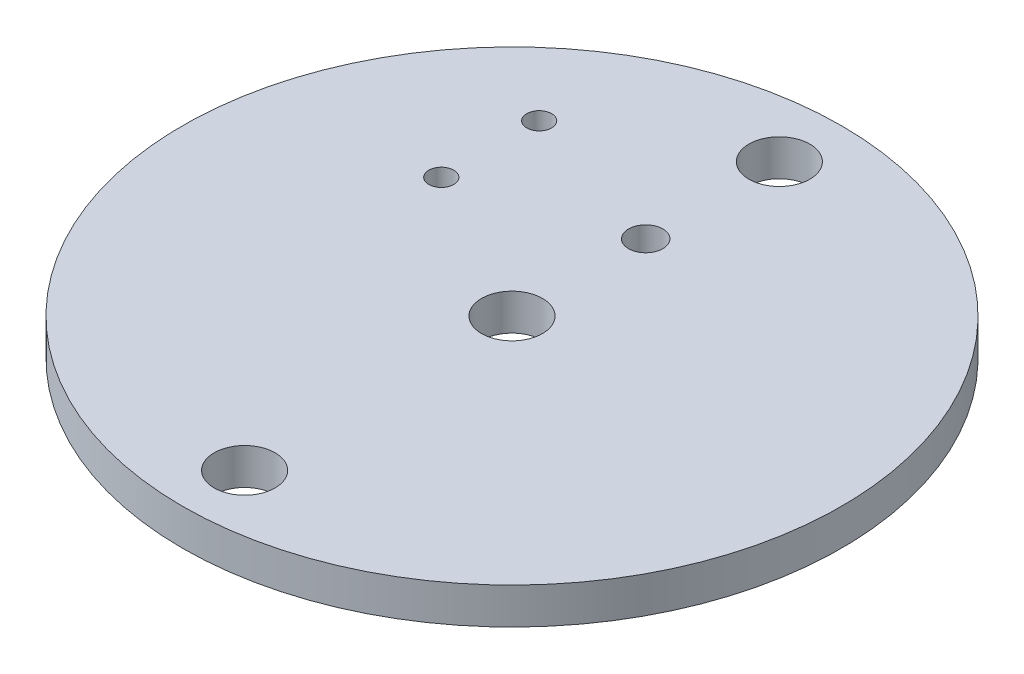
SolidWorks part; units mm, degrees
ref_plane "Front Plane" through (0, 0, 0) normal (0, 0, 1) x (1, 0, 0)
ref_plane "Top Plane" through (0, 0, 0) normal (0, 1, 0) x (1, 0, 0)
ref_plane "Right Plane" through (0, 0, 0) normal (1, 0, 0) x (0, 0, -1)
sketch "Sketch1" plane through (0, 0, 0) normal (0, 1, 0) x (1, 0, 0)
  circle A0 centre (0, 0) radius 26.924
  dimension "D1" = 53.848
extrude "Boss-Extrude1" add sketch "Sketch1" along normal blind 2.9718
hole_wizard "#10 Clearance Hole1" positions "Sketch3" profile "Sketch4" hole size "#10" standard "ANSI Inch"
sketch "Sketch3" plane through (0, 2.9718, 0) normal (0, 1, 0) x (1, 0, 0)
  line L0 (-26.924, 0) -> (26.924, 0) construction
  line L2 (0, 26.924) -> (0, -26.924) construction
  circle A0 centre (0, 0) radius 26.924 construction
  point P0 (0, 0)
  point P21 (0, -21.844)
  point P23 (0, 21.844)
  dimension "D1" = 21.844
  dimension "D2" = 21.844
sketch "Sketch4" plane through (0, 2.9718, 0) normal (1, 0, 0) x (0, 0, 1)
  line L0 (0, 0) -> (0, 2.9718)
  line L1 (0, 2.9718) -> (2.4892, 2.9718)
  line L2 (2.4892, 2.9718) -> (2.4892, 0)
  line L5 (2.4892, 0) -> (0, 0)
  line L11 (0, -6.35) -> (0, 107.95) construction
  dimension "Thru Hole Dia." = 4.9784
  dimension "Thru Hole Depth" = 2.9718
sketch "Sketch5" plane through (0, 2.9718, 0) normal (0, 1, 0) x (1, 0, 0)
  line L0 (0, 21.844) -> (0, 0) construction
  line L1 (0, 10.922) -> (-19.0071, 10.922) construction
  line L2 (-7.747, 17.7165) -> (7.747, 17.7165) construction
  line L3 (-7.747, 17.7165) -> (-7.747, 4.1275) construction
  line L4 (-7.747, 4.1275) -> (7.747, 4.1275) construction
  line L5 (7.747, 17.7165) -> (7.747, 4.1275) construction
  line L6 (-7.747, 17.7165) -> (7.747, 4.1275) construction
  line L7 (-7.747, 4.1275) -> (7.747, 17.7165) construction
  line L8 (-12.7, 17.7165) -> (-12.7, 4.1275) construction
  circle A0 centre (0, 10.922) radius 1.4
  circle A1 centre (-12.7, 14.922) radius 1.016
  circle A2 centre (-12.7, 6.922) radius 1.016
  point P4 (0, 10.922)
  dimension "D1" = 13.589
  dimension "D4" = 2.8
  dimension "D5" = 4
  dimension "D7" = 2.032
  dimension "D8" = 2.032
  dimension "D2" = 15.494
  dimension "D3" = 12.7
  dimension "D6" = 4
extrude "Cut-Extrude1" cut sketch "Sketch5" against normal through all
sketch "Sketch6" plane through (0, 2.9718, 0) normal (0, 1, 0) x (1, 0, 0)
  circle A2 centre (0, 0) radius 27.0256
  circle A3 centre (0, 0) radius 27.0256
  circle A5 centre (0, 21.844) radius 2.3876
  circle A6 centre (0, 21.844) radius 2.3876
  circle A8 centre (-12.7, 14.922) radius 0.9144
  circle A9 centre (-12.7, 14.922) radius 0.9144
  circle A12 centre (-12.7, 6.922) radius 0.9144
  circle A13 centre (-12.7, 6.922) radius 0.9144
  circle A15 centre (0, 10.922) radius 1.2984
  circle A16 centre (0, 10.922) radius 1.2984
  circle A18 centre (0, 0) radius 2.3876
  circle A19 centre (0, 0) radius 2.3876
  circle A21 centre (0, -21.844) radius 2.3876
  circle A22 centre (0, -21.844) radius 2.3876
equation "\"t\"= .117in"
equation "\"kerf\"= .004in"
equation "\"D1@Boss-Extrude1\"=\"t\""
equation "\"D1@Sketch6\"=\"kerf\""
equation "\"D8@Sketch6\"=\"kerf\""
equation "\"D7@Sketch6\"=\"kerf\""
equation "\"D5@Sketch6\"=\"kerf\""
equation "\"D6@Sketch6\"=\"kerf\""
equation "\"D3@Sketch6\"=\"kerf\""
equation "\"D2@Sketch6\"=\"kerf\""
